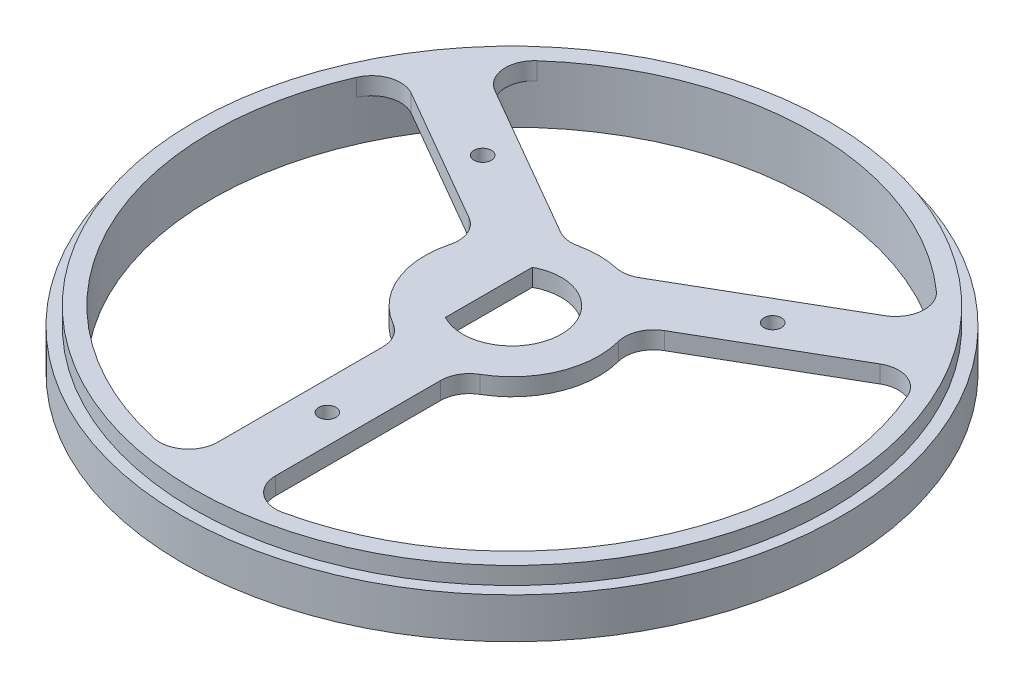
SolidWorks part; units mm, degrees
ref_plane "Front Plane" through (0, 0, 0) normal (0, 0, 1) x (1, 0, 0)
ref_plane "Top Plane" through (0, 0, 0) normal (0, 1, 0) x (1, 0, 0)
ref_plane "Right Plane" through (0, 0, 0) normal (1, 0, 0) x (0, 0, -1)
sketch "Sketch1" plane through (0, 0, 0) normal (0, 1, 0) x (1, 0, 0)
  circle A0 centre (0, 0) radius 56.8401
  circle A1 centre (0, 0) radius 51.85
  dimension "D1" = 113.6801
  dimension "D2" = 103.7
extrude "Boss-Extrude1" add sketch "Sketch1" along normal blind 7
sketch "Sketch2" plane through (0, 7, 0) normal (0, 1, 0) x (1, 0, 0)
  circle A0 centre (0, 0) radius 54.85
  circle A1 centre (0, 0) radius 51.85
  dimension "D1" = 109.7
extrude "Boss-Extrude2" add sketch "Sketch2" along normal blind 3
sketch "Sketch3" plane through (0, 10, 0) normal (0, 1, 0) x (1, 0, 0)
  line L0 (-2.8, 0) -> (-4, 0) construction
  line L1 (-4, 0) -> (-4, 7.5)
  line L2 (-4, 0) -> (-4, -7.5)
  line L3 (-5, -14.1421) -> (-5, -51.6084)
  line L4 (5, -14.1421) -> (5, -51.6084)
  line L5 (-13.1148, 7.2802) -> (-45.0292, 25.706)
  line L6 (-5, 14.1421) -> (-39.2291, 33.9043)
  line L7 (5, 14.1421) -> (39.2291, 33.9043)
  line L8 (13.1148, 7.2802) -> (45.0292, 25.706)
  line L9 (-42.3281, 29.9459) -> (-25.0076, 19.9459) construction
  line L10 (42.3281, 29.9459) -> (25.0076, 19.9459) construction
  line L11 (0, -51.85) -> (0, -31.85) construction
  arc A0 (-13.1148, 7.2802) -> (-5, -14.1421) centre (0, 0) ccw
  arc A1 (-4, -7.5) -> (-4, 7.5) centre (0, 0) ccw
  circle A2 centre (0, 0) radius 2.8 construction
  circle A3 centre (0, 0) radius 51.85 construction
  arc A4 (-39.2291, 33.9043) -> (-45.0292, 25.706) centre (0, 0) ccw
  arc A5 (-5, -51.6084) -> (5, -51.6084) centre (0, 0) ccw
  arc A6 (45.0292, 25.706) -> (39.2291, 33.9043) centre (0, 0) ccw
  arc A7 (5, 14.1421) -> (-5, 14.1421) centre (0, 0) ccw
  arc A8 (5, -14.1421) -> (13.1148, 7.2802) centre (0, 0) ccw
  circle A9 centre (-25.0076, 19.9459) radius 1.5
  circle A10 centre (25.0076, 19.9459) radius 1.5
  circle A11 centre (0, -31.85) radius 1.5
  point P16 (0, -51.85)
  point P34 (0, 0)
  point P35 (0, 0)
  point P36 (0, 0)
  point P37 (0, 0)
  dimension "D1" = 30
  dimension "D2" = 17
  dimension "D3" = 5.6
  dimension "D11" = 3
  dimension "D4" = 1.2
  dimension "D5" = 10
  dimension "D6" = 10
  dimension "D7" = 120
  dimension "D8" = 10
  dimension "D9" = 120
  dimension "D10" = 20
extrude "Boss-Extrude3" add sketch "Sketch3" against normal blind 3
fillet "Fillet1" radius 5 4 edges at (45.0292, 8.5, -25.706) (5, 8.5, 51.6084) (13.1148, 8.5, -7.2802) (5, 8.5, 14.1421)
fillet "Fillet2" radius 5 8 edges at (39.2291, 8.5, -33.9043) (5, 8.5, -14.1421) (-5, 8.5, -14.1421) (-39.2291, 8.5, -33.9043) (-45.0292, 8.5, -25.706) (-13.1148, 8.5, -7.2802) (-5, 8.5, 14.1421) (-5, 8.5, 51.6084)
